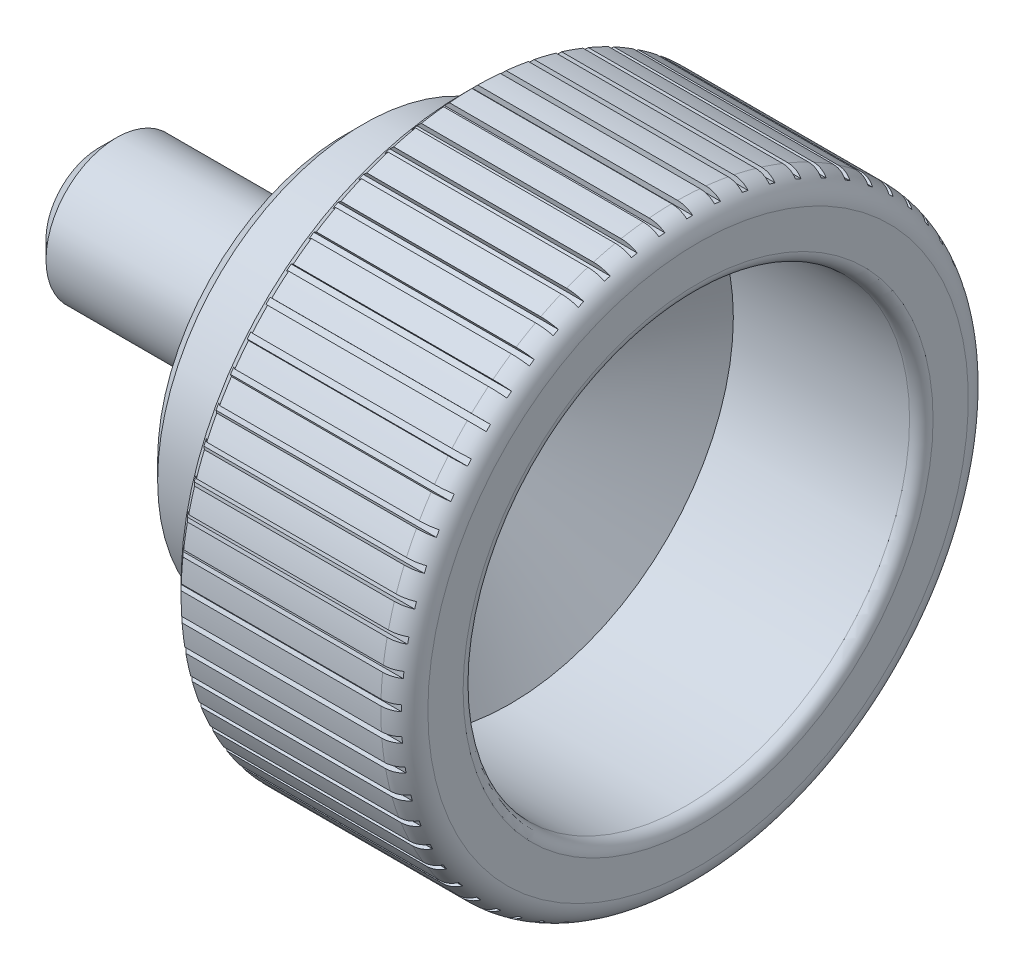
SolidWorks part; units mm, degrees
ref_plane "Plan1" through (0, 0, 0) normal (0, 0, 1) x (1, 0, 0)
ref_plane "Plan2" through (0, 0, 0) normal (0, 1, 0) x (1, 0, 0)
ref_plane "Plan3" through (0, 0, 0) normal (1, 0, 0) x (0, 0, -1)
sketch "Esquisse1" plane through (0, 0, 0) normal (0, 0, 1) x (1, 0, 0)
  line L0 (0, 0) -> (65, 0) construction
  line L1 (0, 0) -> (0, 6)
  line L2 (0, 6) -> (21, 6)
  line L3 (21, 6) -> (21, 17.5)
  line L4 (21, 17.5) -> (31, 17.5)
  line L5 (31, 17.5) -> (31, 25)
  line L6 (31, 25) -> (49, 25)
  line L7 (51, 23) -> (51, 20)
  line L8 (50, 19) -> (35, 19)
  line L9 (35, 19) -> (23.5836, 0)
  line L10 (0, 0) -> (23.5836, 0)
  arc A0 (51, 23) -> (49, 25) centre (49, 23) ccw
  arc A1 (51, 20) -> (50, 19) centre (50, 20) cw
  point P11 (51, 25)
  dimension "D7" = 2
  dimension "D11" = 1
  dimension "D1" = 12
  dimension "D2" = 35
  dimension "D3" = 50
  dimension "D4" = 21
  dimension "D5" = 20
  dimension "D6" = 51
  dimension "D8" = 38
  dimension "D9" = 16
  dimension "D10" = 121
revolve "Base-Révolution" add sketch "Esquisse1" angle 360 about L0
chamfer "Chanfrein1" distance 1 angle 45 1 edges at (31, 0, 25)
chamfer "Chanfrein2" distance 1.5 angle 45 2 edges at (0, 0, 6) (21, 0, 17.5)
sketch "Esquisse2" plane through (51, 0, 0) normal (1, 0, 0) x (0, 0, -1)
  line L0 (0, 0) -> (0, 25.7863) construction
  line L1 (-0.25, 25.3828) -> (-0.25, 24.5309)
  line L2 (0.25, 25.3828) -> (0.25, 24.5309)
  line L3 (0.25, 24.5309) -> (-0.25, 24.5309)
  line L4 (-0.25, 25.3828) -> (0.25, 25.3828)
  dimension "D1" = 0.25
  dimension "D2" = 0.5
extrude "Enlèv. mat.-Extru.1" cut sketch "Esquisse2" against normal up to next
pattern_circular "Répétition circulaire1" count 65 over 360 about axis through (0, 0, 0) along (1, 0, 0) of "Enlèv. mat.-Extru.1"
thread "Filetage1" pitch 1.75 start angle 0, offset 5, length 0, pitch 1.75, diameter 12
ref_plane "Plan4" through (-3.5, 0, -6) normal (0, -1, 0) x (0, 0, -1)
sketch "Profil de filetage1" plane through (-3.5, 0, -6) normal (0, -1, 0) x (0, 0, -1)
  line L0 (0, 0) -> (0, 1.75) construction
  line L11 (0, 0) -> (0, 1.5312)
  line L12 (0, 1.5312) -> (-0.9472, 0.9844)
  line L13 (-0.9472, 0.9844) -> (-0.9472, 0.5469)
  line L15 (-0.9472, 0.5469) -> (0, 0)
  line L17 (-0.9472, 0.7656) -> (0, 0.7656) construction
  point P2 (0, 0)
  dimension "Pitch" = 1.75
  dimension "Profile_Angle" = 60
  dimension "Profile_Land" = 0.4375
  dimension "Profile_Height" = 0.9472
